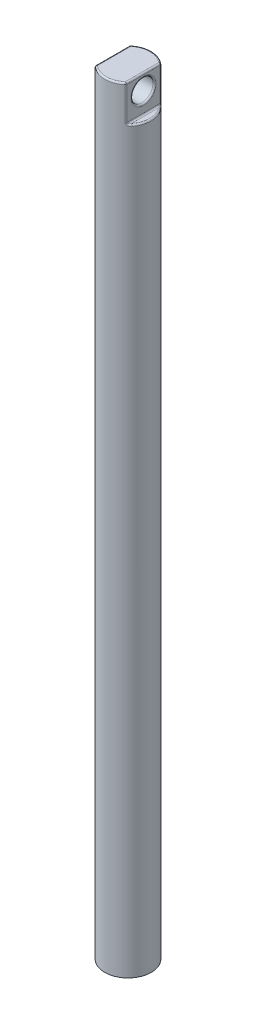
SolidWorks part; units mm, degrees
ref_plane "Front Plane" through (0, 0, 0) normal (0, 0, 1) x (1, 0, 0)
ref_plane "Top Plane" through (0, 0, 0) normal (0, 1, 0) x (1, 0, 0)
ref_plane "Right Plane" through (0, 0, 0) normal (1, 0, 0) x (0, 0, -1)
sketch "Sketch1" plane through (0, 0, 0) normal (0, 1, 0) x (1, 0, 0)
  circle A0 centre (0, 0) radius 4.5
extrude "Boss-Extrude1" add sketch "Sketch1" along normal blind 150
sketch "Sketch2" plane through (0, 150, 0) normal (0, 1, 0) x (1, 0, 0)
  line L0 (0, 0) -> (0, 4.5) construction
  line L1 (0, 4.5) -> (3, 4.5) construction
  line L3 (3, 4.5) -> (-3, 4.5)
  line L4 (3, 4.5) -> (3, -4.5)
  line L5 (3, -4.5) -> (-3, -4.5)
  line L6 (-3, 4.5) -> (-3, -4.5)
  circle A0 centre (0, 0) radius 4.5 construction
  dimension "D1" = 6
extrude "Cut-Extrude1" cut sketch "Sketch2" against normal blind 7 flip side to cut
sketch "Sketch3" plane through (3, 0, 0) normal (1, 0, 0) x (0, 0, -1)
  line L0 (0, 143) -> (0, 147) construction
  line L1 (-3.3541, 143) -> (3.3541, 143) construction
  line L2 (-3.3541, 150) -> (3.3541, 150) construction
  circle A0 centre (0, 147) radius 2.125
  dimension "D1" = 3
  dimension "D2" = 4.25
extrude "Cut-Extrude2" cut sketch "Sketch3" against normal through all
fillet "Fillet1" radius 0.3 14 edges at (-3, 146.5, -3.3541) (-3, 146.5, 3.3541) (-3, 147, 2.125) (-3, 143, 0) (-4.5, 143, 0) (0, 150, -4.5) (0, 150, 4.5) (-3, 150, 0) (3, 150, 0) (3, 146.5, 3.3541) (3, 146.5, -3.3541) (3, 147, -2.125) (3, 143, 0) (4.5, 143, 0)
